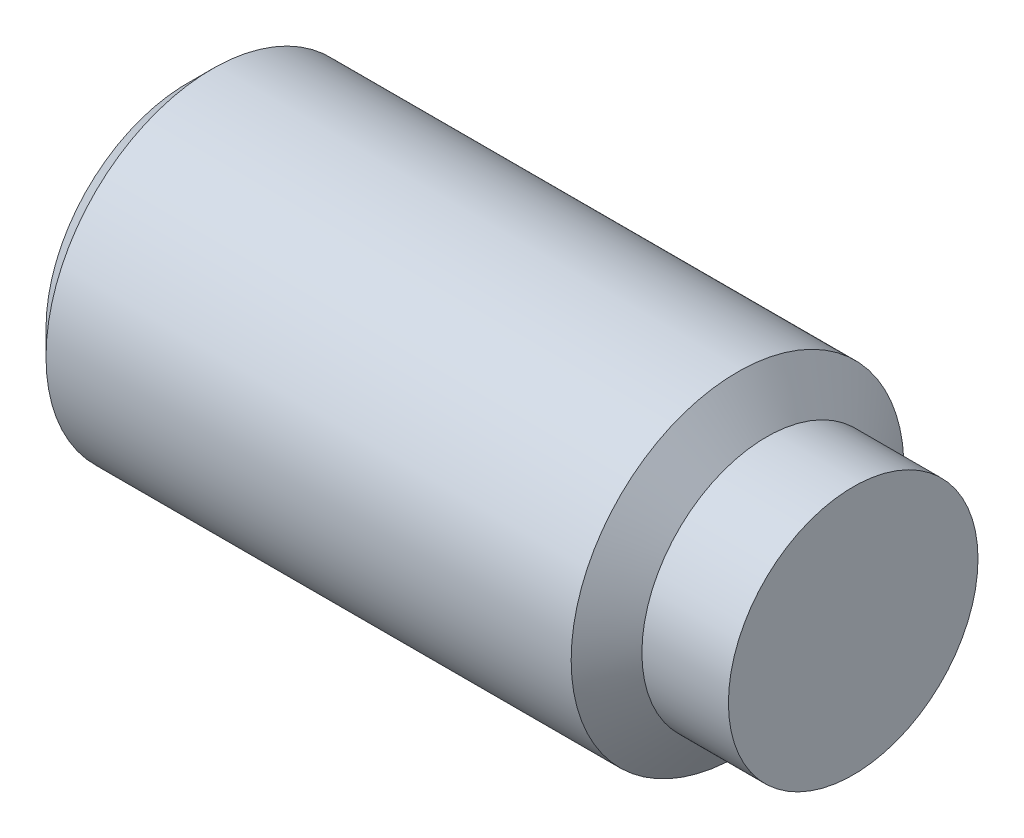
SolidWorks part; units mm, degrees
ref_plane "Plane1" through (0, 0, 0) normal (0, 0, 1) x (1, 0, 0)
ref_plane "Plane2" through (0, 0, 0) normal (0, 1, 0) x (1, 0, 0)
ref_plane "Plane3" through (0, 0, 0) normal (1, 0, 0) x (0, 0, -1)
sketch "BodySke" plane through (0, 0, 0) normal (0, 0, 1) x (1, 0, 0)
  line L0 (0, 0) -> (0, 10.8102)
  line L1 (0, 10.8102) -> (1.8898, 12.7)
  line L2 (1.8898, 12.7) -> (41.9728, 12.7)
  line L3 (41.9728, 12.7) -> (44.196, 9.525)
  line L4 (50.8, 0) -> (0, 0)
  line L5 (-12.7, 0) -> (88.9, 0) construction
  line L6 (44.196, 9.525) -> (50.8, 9.525)
  line L7 (50.8, 9.525) -> (50.8, 0)
  line L8 (0, -10.8102) -> (1.8898, -12.7) construction
  line L9 (44.196, -9.525) -> (50.8, -9.525) construction
  line L10 (2.1082, 15.875) -> (2.1082, -3.175) construction
  dimension "D1" = 55
  dimension "Length" = 50.8
  dimension "Diameter" = 25.4
  dimension "Drive_ch_ang" = 45
  dimension "Minor_dia" = 21.6205
  dimension "Dog_dia" = 19.05
  dimension "Dog_len" = 6.604
  dimension "Advance" = 2.1082
revolve "BaseBody" add sketch "BodySke" angle 360 about L5
sketch "Sketch2" plane through (0, 0, 0) normal (-1, 0, 0) x (0, 0, 1)
  line L0 (4.1208, 7.1374) -> (-4.1208, 7.1374)
  line L1 (-4.1208, 7.1374) -> (-8.2416, 0)
  line L2 (4.1208, 7.1374) -> (8.2416, 0)
  line L3 (4.1208, -7.1374) -> (8.2416, 0)
  line L4 (4.1208, -7.1374) -> (-4.1208, -7.1374)
  line L5 (-4.1208, -7.1374) -> (-8.2416, 0)
  dimension "Hex_size" = 14.2748
  dimension "D2" = 7.1374
  dimension "D3" = 7.1374
extrude "Hex" cut sketch "Sketch2" against normal blind 14.2748
sketch "Sketch4" plane through (0, 4.7709, -0.5249) normal (-1, 0, 0) x (0, 0, 1)
  line L0 (0.5249, -4.7709) -> (10.6976, -4.7709)
  line L1 (0.5249, -4.7709) -> (6.6732, -1.2211) construction
  line L2 (0.5249, -4.7709) -> (5.6112, 4.0389)
  line L3 (8.9666, -2.6687) -> (10.2861, -1.9069)
  line L4 (6.5663, 1.4888) -> (7.8858, 2.2506)
  arc A0 (8.9666, -2.6687) -> (6.5663, 1.4888) centre (0.5249, -4.7709) ccw
  arc A1 (10.6976, -4.7709) -> (10.2861, -1.9069) centre (0.5249, -4.7709) ccw
  arc A2 (5.6112, 4.0389) -> (7.8858, 2.2506) centre (0.5249, -4.7709) cw
  circle A3 centre (0.5249, -4.7709) radius 8.6995 construction
  circle A4 centre (0.5249, -4.7709) radius 10.1727 construction
  dimension "D1" = 30
  dimension "Spline_n_dim" = 17.399
  dimension "Spline_m_dim" = 20.3454
  dimension "Spline_a_dim" = 60
  dimension "D3" = 2.4003
  dimension "Spline_p_dim" = 4.8006
extrude "Spline" [suppressed] cut sketch "Sketch4" against normal blind 12.7
pattern_circular "CirPattern1" [suppressed] count 6 every 60 about axis through (-12.7, 0, 0) along (1, 0, 0)
sketch "ThdSchSke" plane through (0, 0, 0) normal (0, 0, 1) x (1, 0, 0)
  line L0 (1.8898, -10.8102) -> (0.5665, -12.7)
  line L1 (1.8898, -10.8102) -> (3.213, -12.7)
  line L2 (3.213, -12.7) -> (3.213, -15.875)
  line L3 (-3.175, 0) -> (5.1513, 0) construction
  line L4 (1.8898, 12.7) -> (1.8898, -12.7) construction
  line L5 (3.213, -15.875) -> (0.5665, -15.875)
  line L6 (0.5665, -15.875) -> (0.5665, -12.7)
  dimension "Thread_minor" = 21.6205
  dimension "Diameter" = 25.4
  dimension "SideAngle" = 55
  dimension "VeeAngle" = 70
  dimension "Overcut" = 31.75
revolve "ThreadSchematic" [suppressed] cut sketch "ThdSchSke" angle 360 about L3
pattern_linear "ThdSchPat" [suppressed]
equation "\"D2@Sketch2\" = \"Hex_size@Sketch2\" / 2"
equation "\"D3@Sketch2\" = \"Hex_size@Sketch2\" / 2"
equation "\"Thread_minor@ThreadCosmetic\" = \"Minor_dia@BodySke\""
equation "\"D1@Sketch4\" = \"Spline_a_dim@Sketch4\" / 2"
equation "\"D3@Sketch4\" = \"Spline_p_dim@Sketch4\" / 2"
equation "\"D2@CirPattern1\" = \"Spline_a_dim@Sketch4\""
equation "\"Num_teeth@CirPattern1\" = 360 / \"D2@CirPattern1\""
equation "\"Thread_minor@ThdSchSke\" = \"Thread_minor@ThreadCosmetic\""
equation "\"Diameter@ThdSchSke\" = \"Diameter@BodySke\""
equation "\"Overcut@ThdSchSke\" = \"Diameter@BodySke\" * 1.25"
equation "\"Num_threads@ThdSchPat\" = int( (\"Length@BodySke\" - ( ( ( \"Diameter@BodySke\" - \"Minor_dia@BodySke\" ) * 0.5 ) / tan( \"Drive_ch_ang@BodySke\" * 0.017453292 ) ) - \"Dog_len@BodySke\" ) / \"Advance@BodySke\" + "
equation "\"Advance@ThdSchPat\" = (\"Length@BodySke\" - ( ( ( \"Diameter@BodySke\" - \"Minor_dia@BodySke\" ) * 0.5 ) / tan( \"Drive_ch_ang@BodySke\" * 0.017453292 ) ) - \"Dog_len@BodySke\" ) /  (\"Num_threads@ThdSchPat\" - 1"
equation "\"Num_threads@ThdSchPat\" = \"Num_threads@ThdSchPat\" - sgn( \"Num_threads@ThdSchPat\" - 1) '---chamfered tips only---"
